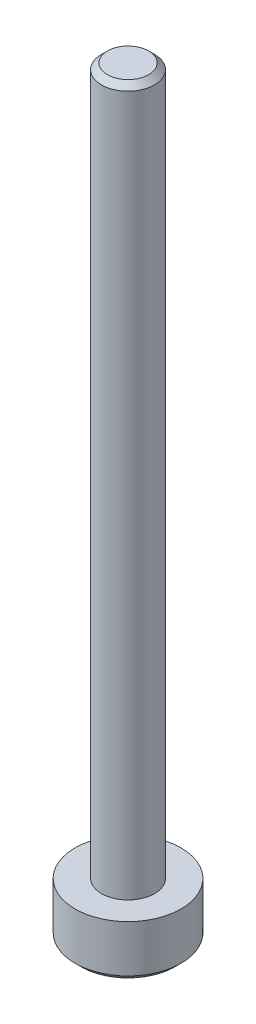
SolidWorks part; units mm, degrees
ref_plane "Front Plane" through (0, 0, 0) normal (0, 0, 1) x (1, 0, 0)
ref_plane "Top Plane" through (0, 0, 0) normal (0, 1, 0) x (1, 0, 0)
ref_plane "Right Plane" through (0, 0, 0) normal (1, 0, 0) x (0, 0, -1)
sketch "Sketch1" plane through (0, 0, 0) normal (0, 1, 0) x (1, 0, 0)
  circle A0 centre (0, 0) radius 1.5
  dimension "D1" = 3
extrude "Boss-Extrude1" add sketch "Sketch1" along normal blind 40
sketch "Sketch2" plane through (0, 0, 0) normal (0, -1, 0) x (1, 0, 0)
  circle A0 centre (0, 0) radius 3
  circle A1 centre (0, 0) radius 1.5 construction
extrude "Boss-Extrude2" add sketch "Sketch2" along normal blind 3 contours A0
sketch "Sketch3" plane through (0, -3, 0) normal (0, -1, 0) x (1, 0, 0)
  line L1 (0, 1.7321) -> (-1.5, 0.866)
  line L2 (-1.5, 0.866) -> (-1.5, -0.866)
  line L3 (-1.5, -0.866) -> (0, -1.7321)
  line L4 (0, -1.7321) -> (1.5, -0.866)
  line L5 (1.5, -0.866) -> (1.5, 0.866)
  line L6 (1.5, 0.866) -> (0, 1.7321)
  circle A0 centre (0, 0) radius 1.5 construction
extrude "Cut-Extrude1" cut sketch "Sketch3" against normal blind 2
chamfer "Chamfer1" distance 0.3333 angle 45 2 edges at (0, 40, 1.5) (0, -3, -3)
equation "\"Length\"= 40"
equation "\"Dia\"= 3"
equation "\"D1@Sketch2\"=\"Dia\"/2"
equation "\"D1@Boss-Extrude2\"=\"Dia\""
equation "\"D1@Sketch3\"=\"Dia\""
equation "\"D1@Cut-Extrude1\"=\"Dia\"/1.5"
equation "\"D1@Chamfer1\"=\"Dia\"/(\"Dia\"*3)"
equation "\"D1@Boss-Extrude1\"=\"Length\""
